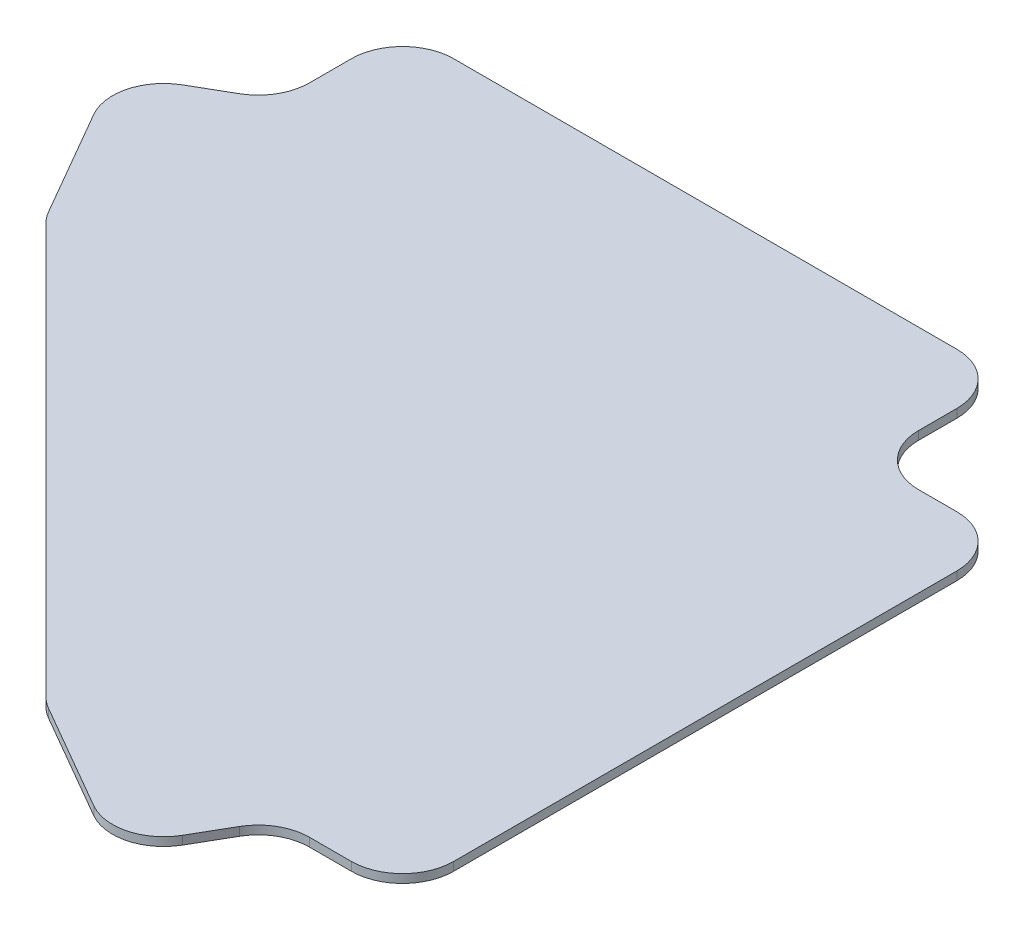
SolidWorks part; units mm, degrees
ref_plane "Front Plane" through (0, 0, 0) normal (0, 0, 1) x (1, 0, 0)
ref_plane "Top Plane" through (0, 0, 0) normal (0, 1, 0) x (1, 0, 0)
ref_plane "Right Plane" through (0, 0, 0) normal (1, 0, 0) x (0, 0, -1)
sketch "Sketch1" plane through (0, 0, 0) normal (0, 1, 0) x (1, 0, 0)
  line L0 (-52.3875, 0) -> (-277.8125, 0)
  line L1 (0, -52.3875) -> (0, -277.8125)
  line L3 (-317.329, -68.4446) -> (-283.5221, -127)
  line L4 (-283.5221, -127) -> (-127, -283.5221)
  line L5 (-127, -283.5221) -> (-68.4446, -317.329)
  line L6 (-106.8622, -273.1516) -> (-35.3632, -314.4316) construction
  line L7 (-273.1516, -106.8622) -> (-314.4316, -35.3632) construction
  line L9 (-277.8125, -28.194) -> (-277.8125, -22.0188)
  line L10 (-277.8125, -45.6298) -> (-277.8125, 0)
  line L12 (-308.7502, -63.4916) -> (-303.877, -60.6781)
  line L13 (-317.329, -68.4446) -> (-277.8125, -45.6298)
  line L15 (-60.6781, -303.877) -> (-63.4916, -308.7502)
  line L16 (-45.6298, -277.8125) -> (-68.4446, -317.329)
  line L18 (-22.0188, -277.8125) -> (-28.194, -277.8125)
  line L19 (0, -277.8125) -> (-45.6298, -277.8125)
  line L21 (-52.3875, -22.5669) -> (-52.3875, -28.194)
  line L22 (-52.3875, 0) -> (-52.3875, -52.3875)
  line L23 (-292.8244, -110.8879) -> (-305.5244, -88.8909) construction
  line L24 (-28.194, -52.3875) -> (-22.5669, -52.3875)
  line L25 (-52.3875, -52.3875) -> (0, -52.3875)
  dimension "D1" = 1.5875
  dimension "D2" = 127
  dimension "D3" = 1.5875
  dimension "D4" = 1.5875
  dimension "D5" = 1.5875
  dimension "D6" = 1.5875
  dimension "D7" = 1.5875
extrude "Boss-Extrude1" add sketch "Sketch1" along normal blind 3.175
fillet "Fillet1" radius 19.05 11 edges at (-52.3875, 1.5875, 52.3875) (-52.3875, 1.5875, 0) (0, 1.5875, 52.3875) (0, 1.5875, 277.8125) (-45.6298, 1.5875, 277.8125) (-68.4446, 1.5875, 317.329) (-127, 1.5875, 283.5221) (-283.5221, 1.5875, 127) (-277.8125, 1.5875, 0) (-277.8125, 1.5875, 45.6298) (-317.329, 1.5875, 68.4446)
